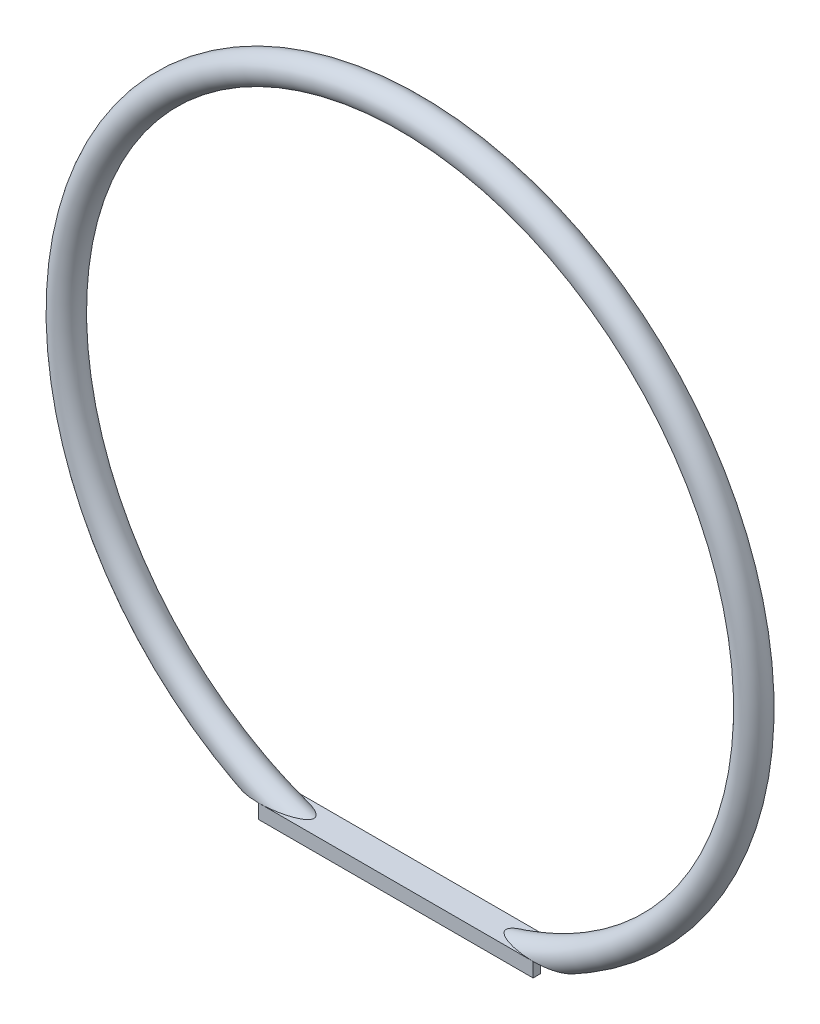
SolidWorks part; units mm, degrees
ref_plane "Front Plane" through (0, 0, 0) normal (0, 0, 1) x (1, 0, 0)
ref_plane "Top Plane" through (0, 0, 0) normal (0, 1, 0) x (1, 0, 0)
ref_plane "Right Plane" through (0, 0, 0) normal (1, 0, 0) x (0, 0, -1)
sketch "Sketch1" plane through (0, 0, 0) normal (0, 0, 1) x (1, 0, 0)
  circle A0 centre (0, 279.4) radius 304.8
  dimension "D1" = 609.6
  dimension "D2" = 279.4
sketch "Sketch2" plane through (0, 0, 0) normal (1, 0, 0) x (0, 0, -1)
  circle A0 centre (0, -25.4) radius 12.7
  circle A1 centre (0, -25.4) radius 8.89
  dimension "D1" = 25.4
  dimension "D2" = 0
  dimension "D3" = 304.8
sweep "Sweep1" add profiles "Sketch2" path "Sketch1"
sketch "Sketch4" plane through (0, 0, 0) normal (0, 1, 0) x (1, 0, 0)
  line L1 (-310.1811, 60.9156) -> (310.1811, 60.9156)
  line L2 (-310.1811, 60.9156) -> (-310.1811, -60.9156)
  line L3 (-310.1811, -60.9156) -> (310.1811, -60.9156)
  line L4 (310.1811, 60.9156) -> (310.1811, -60.9156)
  line L5 (-310.1811, 60.9156) -> (310.1811, -60.9156) construction
  line L6 (-310.1811, -60.9156) -> (310.1811, 60.9156) construction
  point P0 (0, 0)
extrude "Cut-Extrude1" cut sketch "Sketch4" against normal through all contours L2 L3 L4 L1
sketch "Sketch5" plane through (0, 0, 0) normal (0, 1, 0) x (1, 0, 0)
  line L1 (-121.793, -12.7) -> (121.793, -12.7)
  line L2 (-121.793, -12.7) -> (-121.793, 12.7)
  line L3 (-121.793, 12.7) -> (121.793, 12.7)
  line L4 (121.793, -12.7) -> (121.793, 12.7)
  line L5 (-121.793, -12.7) -> (121.793, 12.7) construction
  line L6 (-121.793, 12.7) -> (121.793, -12.7) construction
  spline S0 degree 3 number of poles 121 (85.3778, -1.1656) -> (85.3778, -1.1656) construction
  point P0 (0, 0)
  dimension "D1" = 243.586
extrude "Boss-Extrude1" add sketch "Sketch5" against normal blind 6.35
sketch "Sketch6" plane through (0, -6.35, 0) normal (0, -1, 0) x (1, 0, 0)
  line L0 (121.793, 12.7) -> (121.793, -12.7) construction
  line L1 (-121.793, 12.7) -> (121.793, 12.7)
  line L2 (-121.793, 12.7) -> (-121.793, 6.35)
  line L3 (-121.793, 6.35) -> (121.793, 6.35)
  line L4 (121.793, 12.7) -> (121.793, 6.35)
  line L5 (-121.793, -12.7) -> (-121.793, 12.7) construction
  line L6 (121.793, -12.7) -> (-121.793, -12.7)
  line L7 (121.793, -12.7) -> (121.793, -6.35)
  line L8 (121.793, -6.35) -> (-121.793, -6.35)
  line L9 (-121.793, -12.7) -> (-121.793, -6.35)
  dimension "D1" = 6.35
  dimension "D2" = 6.35
extrude "Boss-Extrude2" add sketch "Sketch6" along normal blind 6.35
